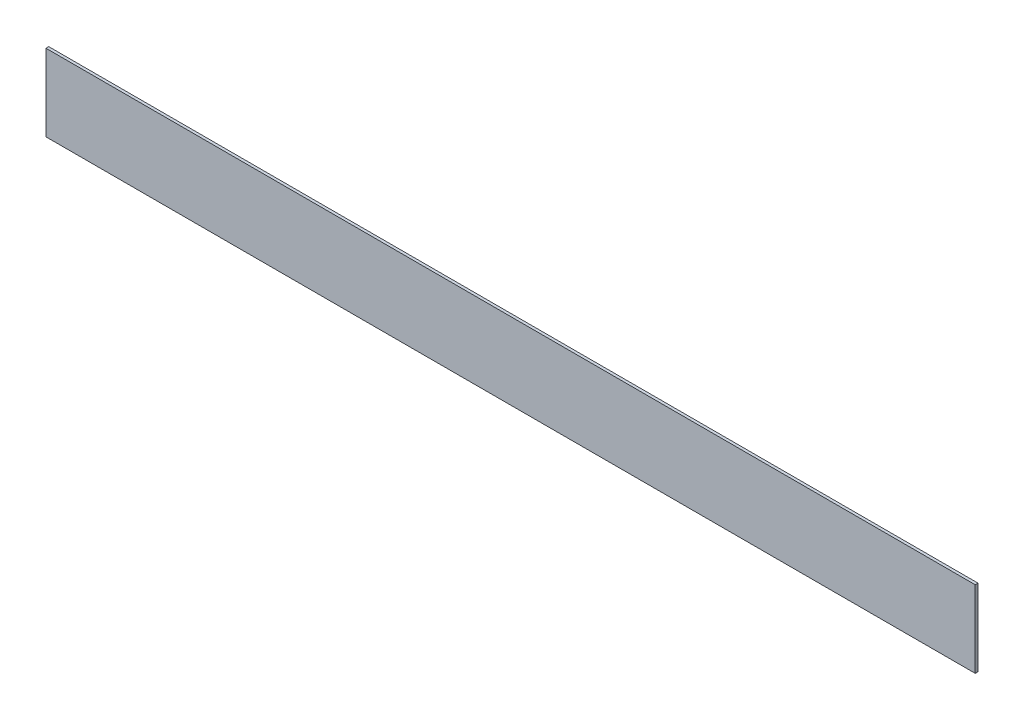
SolidWorks part; units mm, degrees
ref_plane "Alzado" through (0, 0, 0) normal (0, 0, 1) x (1, 0, 0)
ref_plane "Planta" through (0, 0, 0) normal (0, 1, 0) x (1, 0, 0)
ref_plane "Vista lateral" through (0, 0, 0) normal (1, 0, 0) x (0, 0, -1)
sketch "Croquis1" plane through (0, 0, 0) normal (0, 0, 1) x (1, 0, 0)
  line L1 (-1993.75, 553.125) -> (3006.25, 553.125)
  line L2 (-1993.75, 553.125) -> (-1993.75, 140.155)
  line L3 (-1993.75, 140.155) -> (3006.25, 140.155)
  line L4 (3006.25, 553.125) -> (3006.25, 140.155)
  dimension "D1" = 5000
  dimension "D2" = 412.97
extrude "Saliente-Extruir1" add sketch "Croquis1" along normal blind 15
